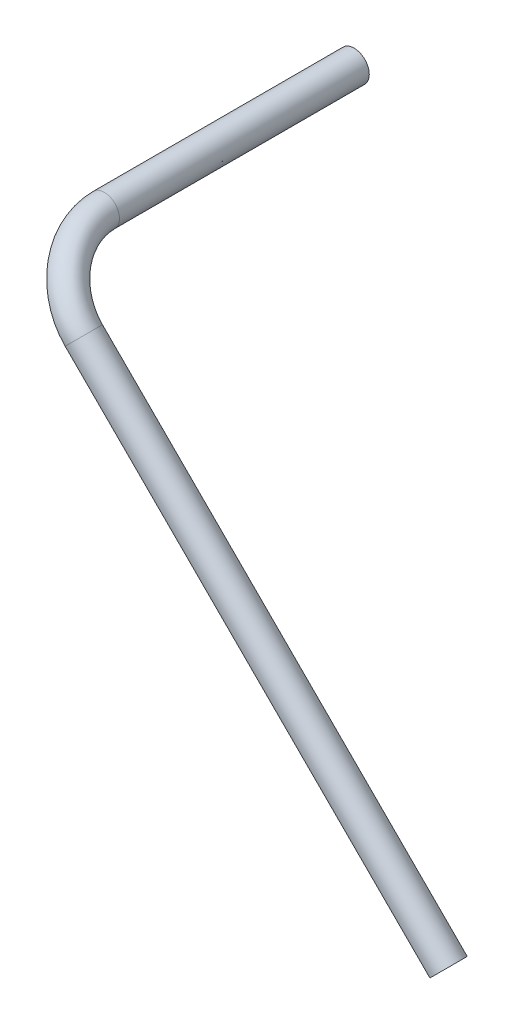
SolidWorks part; units mm, degrees
ref_plane "Front" through (0, 0, 0) normal (0, 0, 1) x (1, 0, 0)
ref_plane "Top" through (0, 0, 0) normal (0, 1, 0) x (1, 0, 0)
ref_plane "Side" through (0, 0, 0) normal (1, 0, 0) x (0, 0, -1)
sketch "PipeSketch"
  dimension "OuterDiameter" = 26.67
  dimension "InnerDiameter" = 20.9296
extrude "Extrusion" add sketch "PipeSketch" along normal blind 218.5173
sketch "FilterSketch" plane through (0, 0, 0) normal (0, 0, 1) x (1, 0, 0)
  circle A0 centre (0, 0) radius 9.525 construction
  dimension "NominalDiameter" = 19.05
sketch "Sketch1" plane through (0, 0, 218.5173) normal (0, 0, 1) x (1, 0, 0)
  line L0 (43.1052, -43.1052) -> (86.2105, 0) construction
  circle A0 centre (0, 0) radius 13.335 construction
  circle A1 centre (0, 0) radius 10.4648 construction
  circle A2 centre (0, 0) radius 13.335
  circle A3 centre (0, 0) radius 10.4648
revolve "Revolve1" add sketch "Sketch1" angle 90 about L0
sketch "Sketch2" plane through (43.1052, -43.1052, 0) normal (0.7071, -0.7071, 0) x (0.7071, 0.7071, 0)
  circle A0 centre (0, 279.4773) radius 10.4648 construction
  circle A1 centre (0, 279.4773) radius 13.335 construction
  circle A2 centre (0, 279.4773) radius 10.4648
  circle A3 centre (0, 279.4773) radius 13.335
extrude "Extrude1" add sketch "Sketch2" along normal blind 451.225
